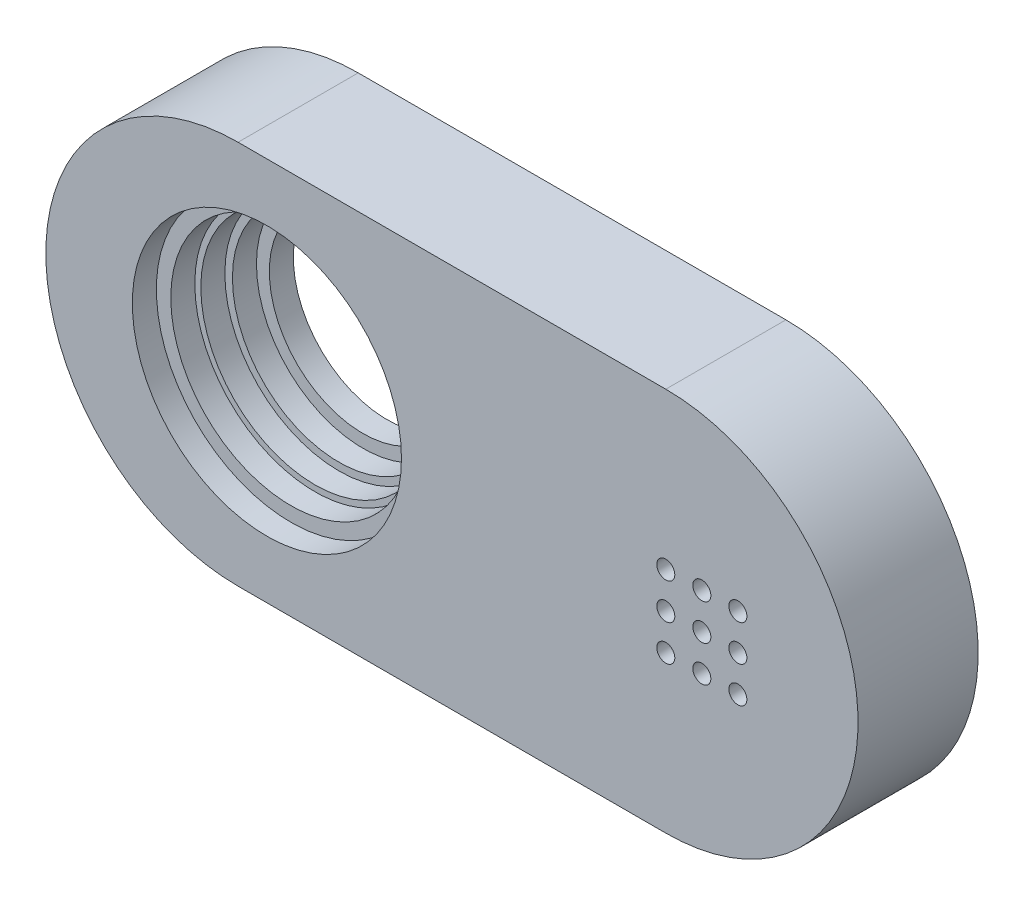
SolidWorks part; units mm, degrees
ref_plane "Front Plane" through (0, 0, 0) normal (0, 0, 1) x (1, 0, 0)
ref_plane "Top Plane" through (0, 0, 0) normal (0, 1, 0) x (1, 0, 0)
ref_plane "Right Plane" through (0, 0, 0) normal (1, 0, 0) x (0, 0, -1)
sketch "Sketch1" plane through (0, 0, 0) normal (0, 0, 1) x (1, 0, 0)
  line L0 (-8.9, 0) -> (8.9, 0) construction
  line L1 (-8.9, 8) -> (8.9, 8)
  line L2 (-8.9, -8) -> (8.9, -8)
  line L3 (0, 4.8795) -> (0, -3.8397) construction
  arc A0 (-8.9, 8) -> (-8.9, -8) centre (-8.9, 0) ccw
  arc A1 (8.9, -8) -> (8.9, 8) centre (8.9, 0) ccw
  point P3 (0, 0)
  dimension "D2" = 17.8
  dimension "D1" = 16
extrude "Boss-Extrude1" add sketch "Sketch1" along normal blind 5
sketch "Sketch2" plane through (0, 0, 5) normal (0, 0, 1) x (1, 0, 0)
  line L0 (0, 0) -> (-20.3647, 0) construction
  circle A0 centre (-7.7, 0) radius 3.9
  arc A1 (-8.9, 8) -> (-8.9, -8) centre (-8.9, 0) ccw construction
  point P2 (-16.9, 0)
  point P6 (-16.9, 0)
  dimension "D1" = 7.8
  dimension "D2" = 9.2
extrude "Cut-Extrude1" cut sketch "Sketch2" against normal blind 5
sketch "Sketch3" plane through (0, 0, 5) normal (0, 0, 1) x (1, 0, 0)
  circle A0 centre (-7.7, 0) radius 4.435
  dimension "D1" = 8.87
extrude "Cut-Extrude2" cut sketch "Sketch3" against normal blind 4
sketch "Sketch4" plane through (0, 0, 5) normal (0, 0, 1) x (1, 0, 0)
  circle A0 centre (-7.7, 0) radius 4.75
  dimension "D1" = 9.5
extrude "Cut-Extrude3" cut sketch "Sketch4" against normal blind 3
sketch "Sketch5" plane through (0, 0, 5) normal (0, 0, 1) x (1, 0, 0)
  circle A0 centre (-7.7, 0) radius 5
  dimension "D1" = 10
extrude "Cut-Extrude4" cut sketch "Sketch5" against normal blind 2
sketch "Sketch6" plane through (0, 0, 5) normal (0, 0, 1) x (1, 0, 0)
  circle A0 centre (-7.7, 0) radius 5.6
  dimension "D1" = 11.2
extrude "Cut-Extrude5" cut sketch "Sketch6" against normal blind 1
sketch "Sketch7" plane through (0, 0, 5) normal (0, 0, 1) x (1, 0, 0)
  line L0 (-0.1318, 0) -> (15.89, 0) construction
  line L1 (0, 1.488) -> (0, -1.3868) construction
  circle A0 centre (10.4, 0) radius 0.375
  arc A1 (8.9, -8) -> (8.9, 8) centre (8.9, 0) ccw construction
  circle A2 centre (8.9, 0) radius 0.375
  circle A3 centre (11.9, 0) radius 0.375
  circle A4 centre (8.9, -1.5) radius 0.375
  circle A5 centre (10.4, -1.5) radius 0.375
  circle A6 centre (11.9, -1.5) radius 0.375
  circle A7 centre (8.9, 1.5) radius 0.375
  circle A8 centre (10.4, 1.5) radius 0.375
  circle A9 centre (11.9, 1.5) radius 0.375
  point P5 (16.9, 0)
  dimension "D1" = 0.75
  dimension "D2" = 6.5
  dimension "D3" = 1.5
  dimension "D4" = 1.5
  dimension "D5" = 1.5
  dimension "D6" = 1.5
  dimension "D7" = 1.5
extrude "Cut-Extrude6" cut sketch "Sketch7" against normal through all
